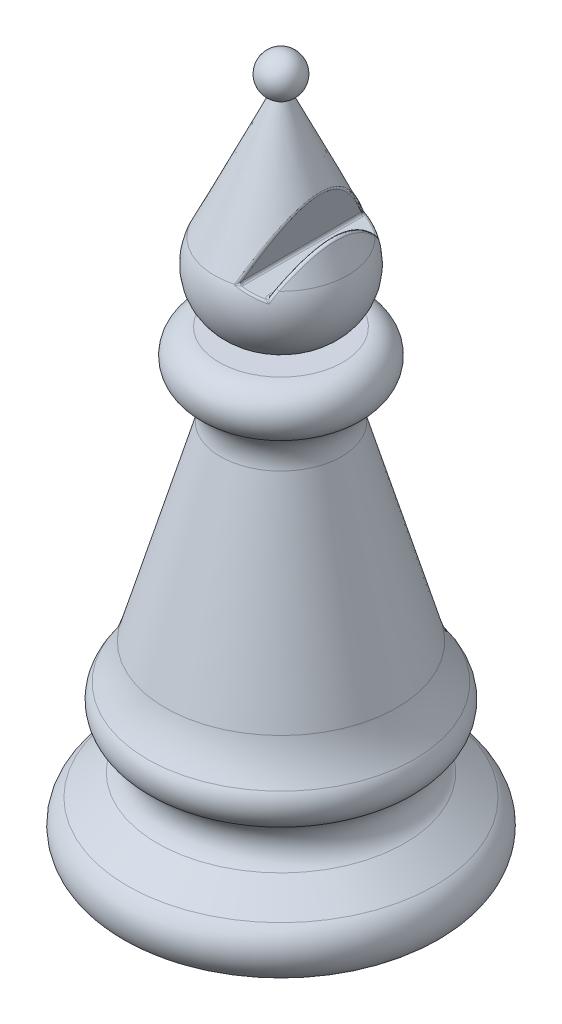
SolidWorks part; units mm, degrees
ref_plane "Front" through (0, 0, 0) normal (0, 0, 1) x (1, 0, 0)
ref_plane "Top" through (0, 0, 0) normal (0, 1, 0) x (1, 0, 0)
ref_plane "Right" through (0, 0, 0) normal (1, 0, 0) x (0, 0, -1)
sketch "Sketch1" plane through (0, 0, 0) normal (0, 0, 1) x (1, 0, 0)
  line L0 (0, 0) -> (0, 72.0534) construction
  line L1 (0, 0) -> (13.97, 0)
  line L2 (15.7696, 5.508) -> (12.6946, 7.7575)
  line L3 (11.8906, 19.4099) -> (6.2269, 38.9246)
  line L4 (6.35, 47.3688) -> (1.7774, 47.3688)
  line L5 (6.8331, 55.3372) -> (0, 69.85)
  line L6 (0, 69.85) -> (0, 0)
  arc A0 (13.97, 0) -> (15.7696, 5.508) centre (13.97, 3.048) ccw
  arc A1 (12.6946, 7.7575) -> (12.9391, 12.0158) centre (14.1943, 9.8076) cw
  arc A2 (12.9391, 12.0158) -> (13.7174, 15.7461) centre (11.684, 14.224) ccw
  arc A3 (13.7174, 15.7461) -> (11.8906, 19.4099) centre (22.8677, 22.5958) cw
  arc A4 (6.2269, 38.9246) -> (7.6752, 42.6619) centre (9.398, 39.845) cw
  arc A5 (7.6752, 42.6619) -> (6.35, 47.3688) centre (6.35, 44.8288) ccw
  arc A6 (1.7774, 47.3688) -> (6.8331, 55.3372) centre (1.7774, 52.9568) ccw
  dimension "D2" = 3.048
  dimension "D4" = 2.54
  dimension "D5" = 11.43
  dimension "D7" = 3.302
  dimension "D8" = 2.54
  dimension "D9" = 5.588
  dimension "D11" = 6.35
  dimension "D12" = 14.224
  dimension "D13" = 11.684
  dimension "D14" = 13.97
  dimension "D15" = 9.398
  dimension "D16" = 1.7774
  dimension "D17" = 52.9568
  dimension "D3" = 3.81
  dimension "D6" = 20.32
  dimension "D10" = 69.85
revolve "Base-Revolve" add sketch "Sketch1" angle 360 about L0
sketch "Sketch2" plane through (0, 0, 0) normal (0, 0, 1) x (1, 0, 0)
  line L0 (0, 67.818) -> (0, 71.882)
  line L1 (0, 69.85) -> (0, 75.6613) construction
  arc A0 (0, 67.818) -> (0, 71.882) centre (0, 69.85) ccw
  dimension "D1" = 2.032
revolve "Boss-Revolve1" add sketch "Sketch2" angle 360 about L1
sketch "Sketch3" plane through (0, 0, 0) normal (0, 0, 1) x (1, 0, 0)
  line L0 (2.058, 55.3372) -> (5.0381, 64.1384)
  line L1 (2.058, 55.3372) -> (4.1134, 54.6412)
  line L2 (5.0381, 64.1384) -> (7.0934, 63.4425)
  line L3 (4.1134, 54.6412) -> (7.0934, 63.4425)
  line L4 (6.8331, 55.3372) -> (-6.8331, 55.3372) construction
extrude "Cut-Extrude1" cut sketch "Sketch3" against normal through all and the other way through all
fillet "Fillet1" radius 0.254 6 edges at (5.3881, 58.4061, -0.0201) (4.0534, 61.2302, -0.2034)
fillet "Fillet2" radius 0.254 10 edges at (4.3447, 54.5084, -5.6381) (4.1357, 54.6337, -5.4345) (4.3447, 54.5084, 5.6381) (4.1558, 54.6269, 5.4783) (1.8386, 55.3006, -6.5961) (1.8277, 55.2959, 6.6027) (4.1134, 54.6412, 0) (2.058, 55.3372, 0)
